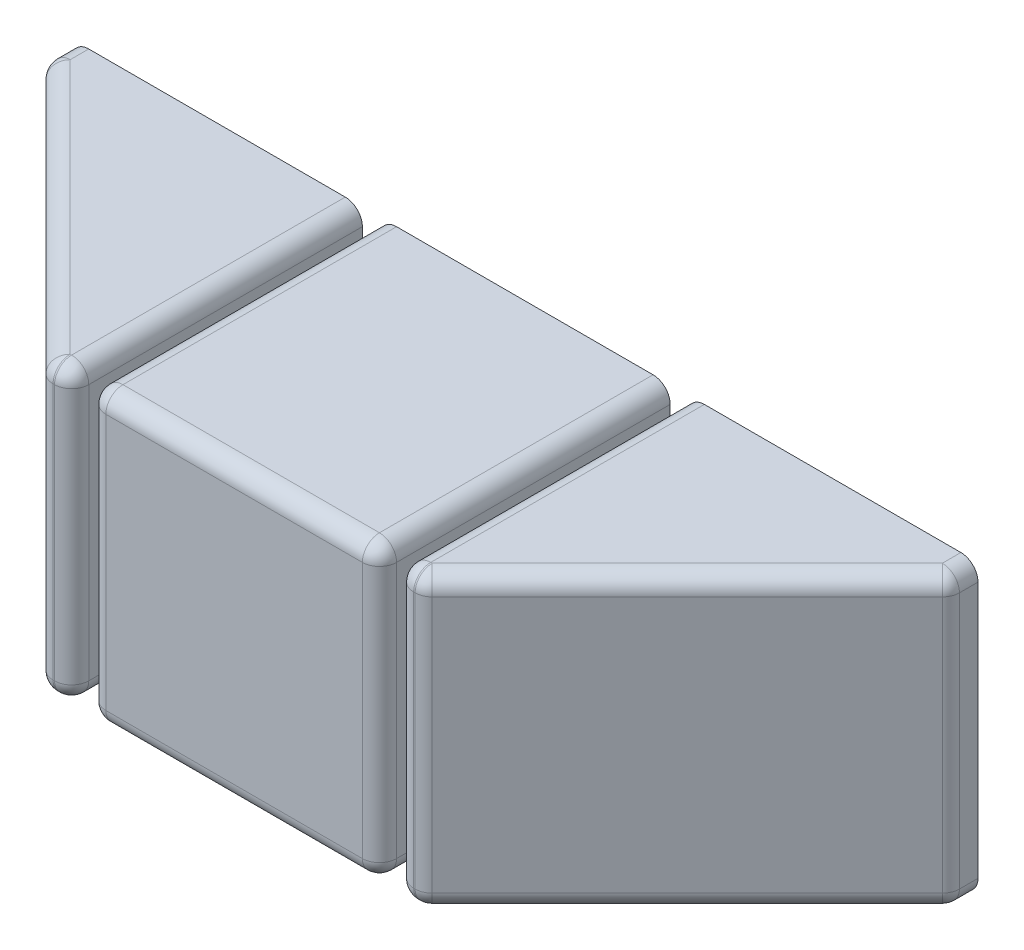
SolidWorks part; units mm, degrees
ref_plane "Front Plane" through (0, 0, 0) normal (0, 0, 1) x (1, 0, 0)
ref_plane "Top Plane" through (0, 0, 0) normal (0, 1, 0) x (1, 0, 0)
ref_plane "Right Plane" through (0, 0, 0) normal (1, 0, 0) x (0, 0, -1)
sketch "Sketch1" plane through (0, 0, 0) normal (0, 0, 1) x (1, 0, 0)
  line L0 (0, 85) -> (0, -85) construction
  line L1 (75, -85) -> (-75, -85)
  line L2 (85, -75) -> (85, 75)
  line L3 (75, 85) -> (-75, 85)
  line L4 (-85, -75) -> (-85, 75)
  line L5 (85, -85) -> (-85, 85) construction
  line L6 (85, 85) -> (-85, -85) construction
  line L7 (-105, -85) -> (-255, -85)
  line L8 (-95, -75) -> (-95, 75)
  line L9 (-105, 85) -> (-255, 85)
  line L10 (-265, -75) -> (-265, 75)
  line L11 (-95, -85) -> (-265, 85) construction
  line L12 (-95, 85) -> (-265, -85) construction
  line L13 (95, 85) -> (265, -85) construction
  line L14 (95, -85) -> (265, 85) construction
  line L15 (265, -75) -> (265, 75)
  line L16 (105, 85) -> (255, 85)
  line L17 (95, -75) -> (95, 75)
  line L18 (105, -85) -> (255, -85)
  line L19 (85, -85) -> (85, 85)
  arc A0 (255, 85) -> (265, 75) centre (255, 75) cw
  arc A1 (255, -85) -> (265, -75) centre (255, -75) ccw
  arc A2 (105, -85) -> (95, -75) centre (105, -75) cw
  arc A3 (95, 75) -> (105, 85) centre (105, 75) cw
  arc A4 (85, 75) -> (75, 85) centre (75, 75) ccw
  arc A5 (75, -85) -> (85, -75) centre (75, -75) ccw
  arc A6 (-75, -85) -> (-85, -75) centre (-75, -75) cw
  arc A7 (-75, 85) -> (-85, 75) centre (-75, 75) ccw
  arc A8 (-95, 75) -> (-105, 85) centre (-105, 75) ccw
  arc A9 (-105, -85) -> (-95, -75) centre (-105, -75) ccw
  arc A10 (-255, -85) -> (-265, -75) centre (-255, -75) cw
  arc A11 (-255, 85) -> (-265, 75) centre (-255, 75) ccw
  point P0 (0, 0)
  point P6 (-180, 0)
  point P17 (180, 0)
  dimension "D7" = 10
  dimension "D1" = 170
  dimension "D2" = 170
  dimension "D3" = 170
  dimension "D4" = 170
  dimension "D5" = 10
  dimension "D6" = 0
extrude "Boss-Extrude1" add sketch "Sketch1" along normal blind 170 contours A10 L10 A11 L9 A8 L8 A9 L7 | A5 L1 A6 L4 A7 L3 A4 L2 | L15 A0 L16 A3 L17 A2 L18 A1
sketch "Sketch2" plane through (0, 85, 0) normal (0, 1, 0) x (1, 0, 0)
  line L1 (-105, -170) -> (-255, -170) construction
  line L2 (-110, -170) -> (-265, -15)
  line L5 (-265, -15) -> (-265, -170)
  line L6 (-265, -170) -> (-110, -170)
  line L7 (0, 0) -> (0, -170) construction
  line L8 (75, -170) -> (-75, -170) construction
  line L9 (265, -170) -> (110, -170)
  line L10 (265, -15) -> (265, -170)
  line L11 (110, -170) -> (265, -15)
  line L12 (-265, -170) -> (-265, 0) construction
  line L13 (-105, 0) -> (-255, 0) construction
  dimension "D1" = 45
  dimension "D2" = 15
extrude "Cut-Extrude1" cut sketch "Sketch2" against normal through all
fillet "Fillet1" radius 10 11 edges at (-97.9289, 82.0711, 170) (-95, 0, 170) (-97.9289, -82.0711, 170) (-107.5, -85, 170) (-107.5, 85, 170) (-182.5, 85, 97.5) (-110, 0, 170) (-182.5, -85, 97.5) (-262.0711, 82.0711, 17.9289) (-262.0711, -82.0711, 17.9289) (-265, 0, 15)
fillet "Fillet2" radius 10 8 edges at (82.0711, -82.0711, 170) (0, -85, 170) (-82.0711, -82.0711, 170) (-85, 0, 170) (-82.0711, 82.0711, 170) (0, 85, 170) (82.0711, 82.0711, 170) (85, 0, 170)
fillet "Fillet3" radius 10 11 edges at (182.5, -85, 97.5) (182.5, 85, 97.5) (107.5, -85, 170) (97.9289, -82.0711, 170) (95, 0, 170) (97.9289, 82.0711, 170) (107.5, 85, 170) (110, 0, 170) (262.0711, -82.0711, 17.9289) (262.0711, 82.0711, 17.9289) (265, 0, 15)
